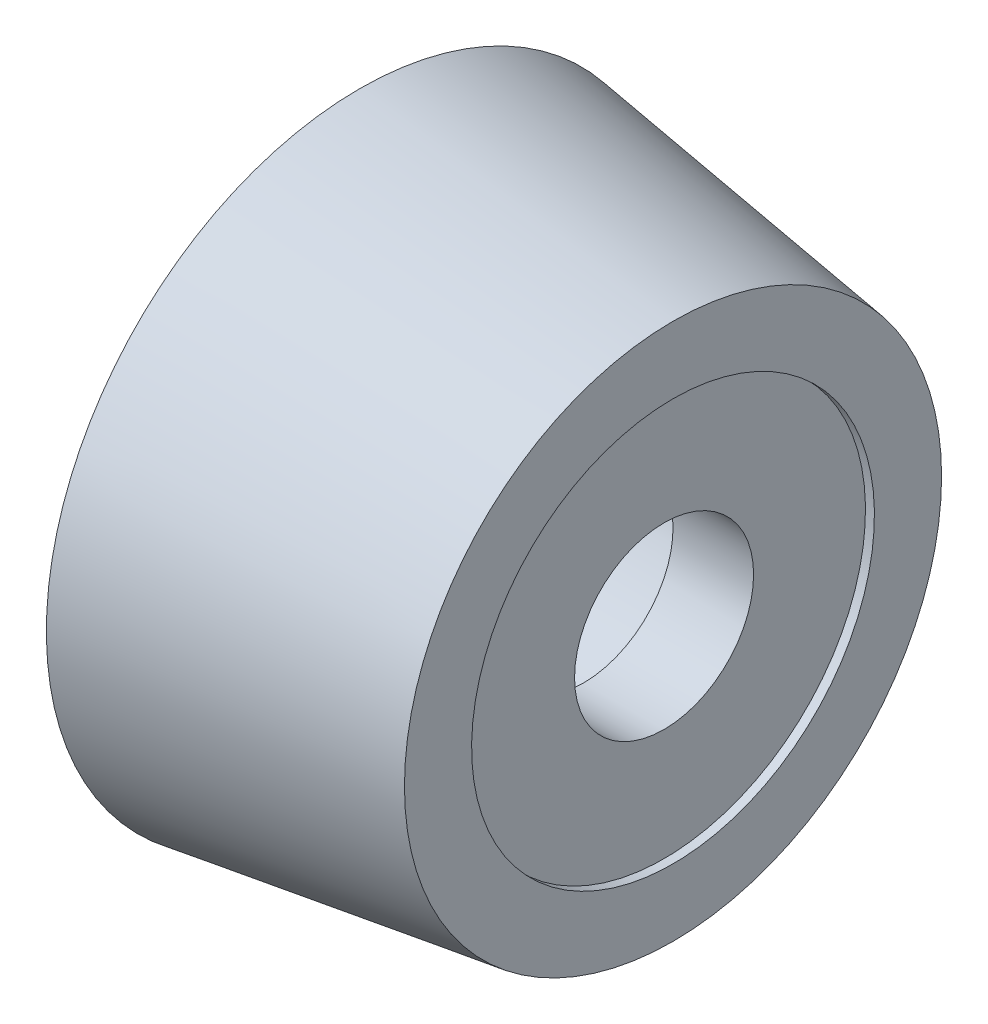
SolidWorks part; units mm, degrees
ref_plane "Plan de face" through (0, 0, 0) normal (0, 0, 1) x (1, 0, 0)
ref_plane "Plan de dessus" through (0, 0, 0) normal (0, 1, 0) x (1, 0, 0)
ref_plane "Plan de droite" through (0, 0, 0) normal (1, 0, 0) x (0, 0, -1)
sketch "Esquisse1" plane through (0, 0, 0) normal (0, 0, 1) x (1, 0, 0)
  line L0 (-18.0928, 0) -> (-18.0928, 7)
  line L1 (-18.0928, 7) -> (-11.0928, 6)
  line L2 (-11.0928, 6) -> (-11.0928, 0)
  line L3 (-11.0928, 0) -> (-18.0928, 0)
  dimension "D1" = 7
  dimension "D2" = 7
  dimension "D3" = 6
revolve "Révolution1" add sketch "Esquisse1" angle 360 about L3
sketch "Esquisse2" plane through (-18.0928, 0, 0) normal (-1, 0, 0) x (0, 0, 1)
  circle A0 centre (0, 0) radius 3.5
  dimension "D1" = 7
extrude "Enlèv. mat.-Extru.1" cut sketch "Esquisse2" against normal blind 5
sketch "Esquisse3" plane through (-13.0928, 0, 0) normal (-1, 0, 0) x (0, 0, 1)
  circle A0 centre (0, 0) radius 2
  dimension "D1" = 4
extrude "Enlèv. mat.-Extru.2" cut sketch "Esquisse3" against normal through all
sketch "Esquisse4" plane through (-11.0928, 0, 0) normal (1, 0, 0) x (0, 0, -1)
  circle A0 centre (0, 0) radius 4.5
  dimension "D1" = 9
extrude "Enlèv. mat.-Extru.3" cut sketch "Esquisse4" against normal blind 0.2
sketch "Esquisse5" plane through (-18.0928, 0, 0) normal (-1, 0, 0) x (0, 0, 1)
  circle A0 centre (3.5, 0) radius 1.2503
  circle A1 centre (0, 0) radius 3.5 construction
  dimension "D1" = 2.5006
extrude "Enlèv. mat.-Extru.4" cut sketch "Esquisse5" against normal up to surface (5 mm away)
